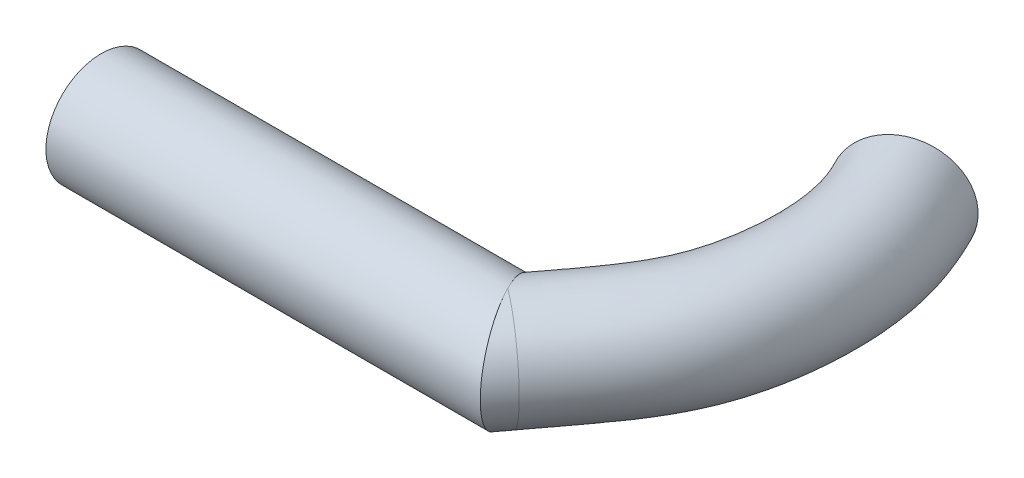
SolidWorks part; units mm, degrees
ref_plane "Vorne" through (0, 0, 0) normal (0, 0, 1) x (1, 0, 0)
ref_plane "Oben" through (0, 0, 0) normal (0, 1, 0) x (1, 0, 0)
ref_plane "Rechts" through (0, 0, 0) normal (1, 0, 0) x (0, 0, -1)
sketch "Skizze1" plane through (0, 0, 0) normal (0, 1, 0) x (1, 0, 0)
  line L1 (0, 0) -> (78.3138, 0)
  line L2 (0, 0) -> (0, 61.3862)
  line L3 (0, 61.3862) -> (78.3138, 61.3862)
  line L4 (78.3138, 0) -> (78.3138, 61.3862)
sketch "Skizze2" plane through (0, 0, 0) normal (0, 0, 1) x (1, 0, 0)
  line L0 (0, 0) -> (0, 53.7384)
  line L1 (0, 53.7384) -> (78.3138, 53.7384)
  line L2 (78.3138, 53.7384) -> (78.3138, 0)
ref_plane "Ebene1" through (78.3138, 53.7384, 0) normal (0, -1, 0) x (1, 0, 0)
sketch "Skizze3" plane through (78.3138, 53.7384, 0) normal (0, -1, 0) x (1, 0, 0)
  line L0 (0, 0) -> (8.4016, -11.3263)
  arc A0 (8.4016, -11.3263) -> (12.7156, -63.5617) centre (-31.4894, -40.9166) cw
other "Strukturbauteil2"
ref_plane "Ebene3" through (86.7154, 53.7384, -11.3263) normal (0.5958, 0, -0.8032) x (-0.8032, 0, -0.5958)
sketch "Sketch1" plane through (86.7154, 53.7384, -11.3263) normal (0.5958, 0, -0.8032) x (-0.8032, 0, -0.5958)
  circle A0 centre (0, 0) radius 8.35
  circle A1 centre (0, 0) radius 10.65
  point P3 (0, 0)
  dimension "In_dia" = 16.7
  dimension "Out_dia" = 21.3
sketch "Skizze4" plane through (78.3138, 53.7384, 0) normal (0, -1, 0) x (1, 0, 0)
  line L0 (0, 0) -> (8.4016, -11.3263) construction
  line L1 (12.7156, -63.5617) -> (5.0392, -78.5466) construction
  line L2 (0, 0) -> (-12.6645, 17.0731)
  arc A0 (12.7156, -63.5617) -> (8.4016, -11.3263) centre (-31.4894, -40.9166) ccw construction
  spline S0 degree 3 poles (0, 0) (7.0514, -9.5061) (16.3727, -20.3536) (19.1074, -45.461) (15.7694, -57.6005) (12.7156, -63.5617) knots 0 0 0 0 0.414647 0.736838 1 1 1 1
ref_plane "Ebene4" through (91.0294, 53.7384, -63.5617) normal (-0.4559, 0, -0.89) x (-0.89, 0, 0.4559)
sketch "Skizze5" plane through (91.0294, 53.7384, -63.5617) normal (-0.4559, 0, -0.89) x (-0.89, 0, 0.4559)
  circle A0 centre (0, 0) radius 10.65 construction
  circle A1 centre (0, 0) radius 8.35 construction
  circle A2 centre (0, 0) radius 10.65
  circle A3 centre (0, 0) radius 8.35
sweep "Austragung1" add profiles "Skizze5" path "Skizze4"
ref_plane "Ebene5" through (62.4853, 0, -31.4492) normal (0.8932, 0, -0.4496) x (-0.4496, 0, -0.8932)
other "Oberflächenschnitt1"
delete or keep bodies "Körper-Löschen1" type delete bodies bodies 105 104
